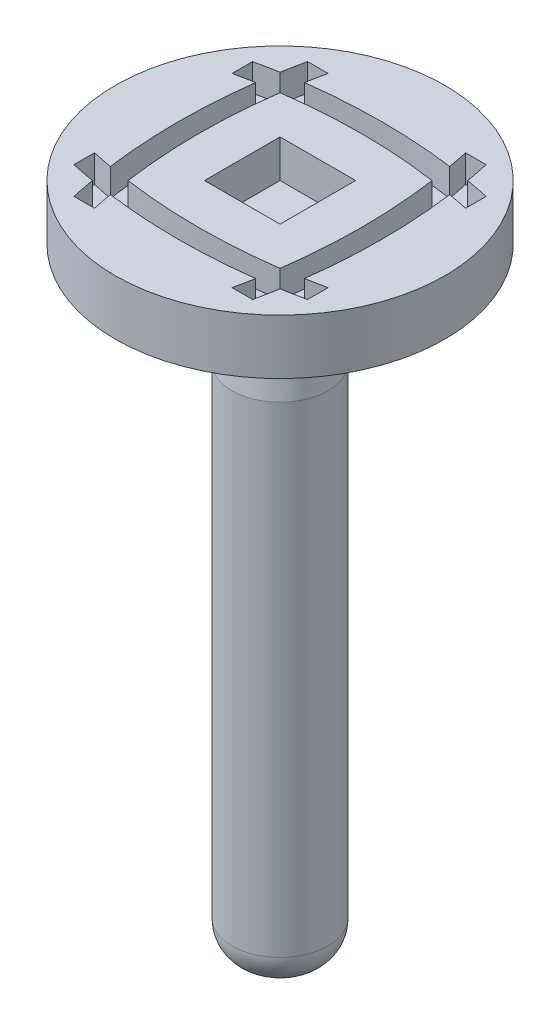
SolidWorks part; units mm, degrees
ref_plane "Front Plane" through (0, 0, 0) normal (0, 0, 1) x (1, 0, 0)
ref_plane "Top Plane" through (0, 0, 0) normal (0, 1, 0) x (1, 0, 0)
ref_plane "Right Plane" through (0, 0, 0) normal (1, 0, 0) x (0, 0, -1)
sketch "Sketch1" plane through (0, 0, 0) normal (0, 1, 0) x (1, 0, 0)
  circle A0 centre (0, 0) radius 24
  dimension "D1" = 48
extrude "Boss-Extrude1" add sketch "Sketch1" along normal blind 8
sketch "Sketch3" plane through (0, 8, 0) normal (0, 1, 0) x (1, 0, 0)
  line L0 (-5.5, 5.5) -> (5.5, 5.5)
  line L1 (5.5, 5.5) -> (5.5, -5.5)
  line L2 (5.5, -5.5) -> (-5.5, -5.5)
  line L3 (-5.5, -5.5) -> (-5.5, 5.5)
  dimension "D1" = 11
  dimension "D2" = 5.5
  dimension "D3" = 11
  dimension "D4" = 5.5
extrude "Cut-Extrude2" cut sketch "Sketch3" against normal blind 5.5
sketch "Sketch10" plane through (0, 8, 0) normal (0, 1, 0) x (1, 0, 0)
  line L1 (-17, 13) -> (-17, 10)
  line L3 (17, 10) -> (17, 13)
  line L4 (10, -17) -> (13, -17)
  line L5 (13, 17) -> (10, 17)
  line L7 (-17, -10) -> (-17, -13)
  line L8 (17, -13) -> (17, -10)
  line L10 (-10, 17) -> (-13, 17)
  line L11 (-13, -17) -> (-10, -17)
  arc A0 (-17, 13) -> (-13.6534, 13.6534) centre (0, -65.1729) cw
  arc A1 (-17, 10) -> (-14.125, 10.5759) centre (0, -67.4053) cw
  arc A2 (10, 17) -> (10.5759, 14.125) centre (-67.4053, 0) cw
  arc A3 (13, 17) -> (13.6534, 13.6534) centre (-65.1729, 0) cw
  arc A4 (17, -10) -> (14.125, -10.5759) centre (0, 67.4053) cw
  arc A5 (17, -13) -> (13.6534, -13.6534) centre (0, 65.1729) cw
  arc A6 (-10, -17) -> (-10.5759, -14.125) centre (67.4053, 0) cw
  arc A7 (-13, -17) -> (-13.6534, -13.6534) centre (65.1729, 0) cw
  arc A8 (-10.5759, 14.125) -> (-10, 17) centre (67.4053, 0) cw
  arc A9 (-13.6534, 13.6534) -> (-13, 17) centre (65.1729, 0) cw
  arc A10 (-11.0681, 11.0681) -> (11.0681, 11.0681) centre (0, -67.4053) cw
  arc A11 (-10.5759, 14.125) -> (10.5759, 14.125) centre (0, -65.1729) cw
  arc A12 (13.6534, 13.6534) -> (17, 13) centre (0, -65.1729) cw
  arc A13 (14.125, 10.5759) -> (17, 10) centre (0, -67.4053) cw
  arc A14 (11.0681, 11.0681) -> (11.0681, -11.0681) centre (-67.4053, 0) cw
  arc A15 (14.125, 10.5759) -> (14.125, -10.5759) centre (-65.1729, 0) cw
  arc A16 (13.6534, -13.6534) -> (13, -17) centre (-65.1729, 0) cw
  arc A17 (10.5759, -14.125) -> (10, -17) centre (-67.4053, 0) cw
  arc A18 (11.0681, -11.0681) -> (-11.0681, -11.0681) centre (0, 67.4053) cw
  arc A19 (10.5759, -14.125) -> (-10.5759, -14.125) centre (0, 65.1729) cw
  arc A20 (-13.6534, -13.6534) -> (-17, -13) centre (0, 65.1729) cw
  arc A21 (-14.125, -10.5759) -> (-14.125, 10.5759) centre (65.1729, 0) cw
  arc A22 (-14.125, -10.5759) -> (-17, -10) centre (0, 67.4053) cw
  arc A23 (-11.0681, -11.0681) -> (-11.0681, 11.0681) centre (67.4053, 0) cw
  point P36 (0, 0)
extrude "Cut-Extrude6" cut sketch "Sketch10" against normal blind 4
sketch "Sketch11" plane through (0, 0, 0) normal (0, 0, 1) x (1, 0, 0)
  line L0 (0, 0) -> (0, -90)
  line L1 (0, -90) -> (7, -90)
  line L2 (7, -90) -> (7, -15)
  line L3 (7, -15) -> (5, 0)
  line L4 (-24, 0) -> (24, 0) construction
  line L5 (5, 0) -> (0, 0)
  dimension "D1" = 90
  dimension "D2" = 5
  dimension "D3" = 15
  dimension "D4" = 7
revolve "Revolve1" add sketch "Sketch11" angle 360 about L0
fillet "Fillet1" radius 5 1 edges at (-7, -90, 0)
equation "\"D2@Sketch10\"=\"D1@Sketch10\"/2"
